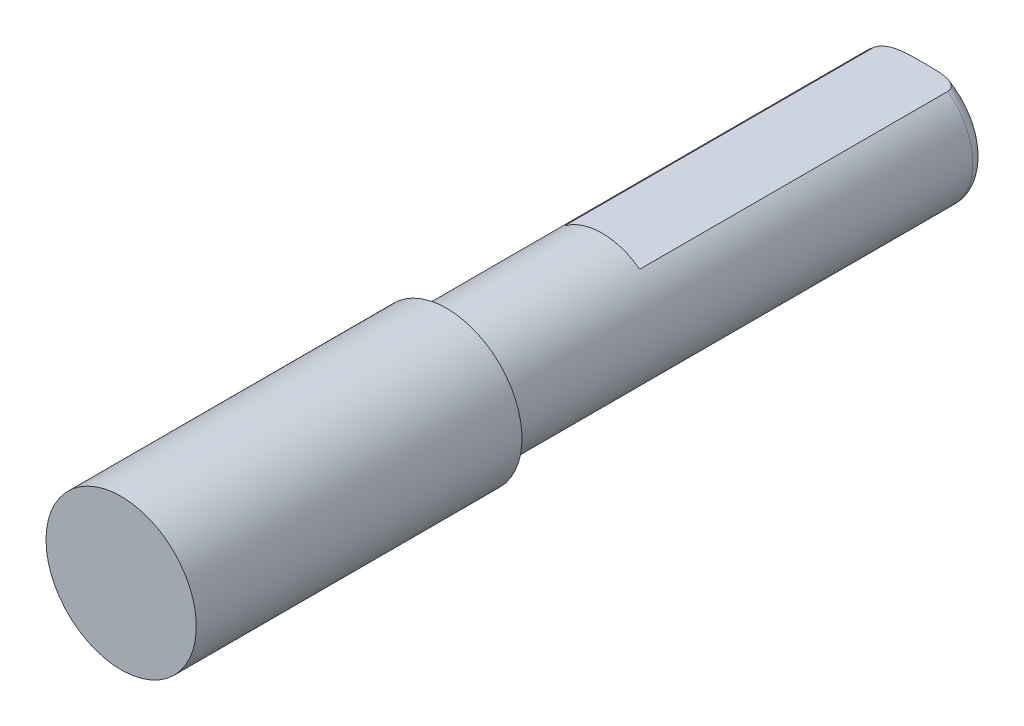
SolidWorks part; units mm, degrees
ref_plane "前视" through (0, 0, 0) normal (0, 0, 1) x (1, 0, 0)
ref_plane "上视" through (0, 0, 0) normal (0, 1, 0) x (1, 0, 0)
ref_plane "右视" through (0, 0, 0) normal (1, 0, 0) x (0, 0, -1)
sketch "草图1" plane through (0, 0, 0) normal (0, 0, 1) x (1, 0, 0)
  circle A0 centre (0, 0) radius 2.5
extrude "凸台-拉伸1" add sketch "草图1" along normal blind 19
sketch "草图2" plane through (0, 0, 19) normal (0, 0, 1) x (1, 0, 0)
  circle A0 centre (0, 0) radius 3
  dimension "D1" = 6
extrude "凸台-拉伸2" add sketch "草图2" along normal blind 13
sketch "草图3" plane through (0, 0, 0) normal (0, 0, -1) x (-1, 0, 0)
  line L0 (-1.5, 2) -> (1.5, 2)
  arc A0 (1.5, 2) -> (-1.5, 2) centre (0, 0) ccw
extrude "切除-拉伸1" cut sketch "草图3" against normal blind 12.8
fillet "圆角1" radius 0.5 1 edges at (0, -2.5, 0)
